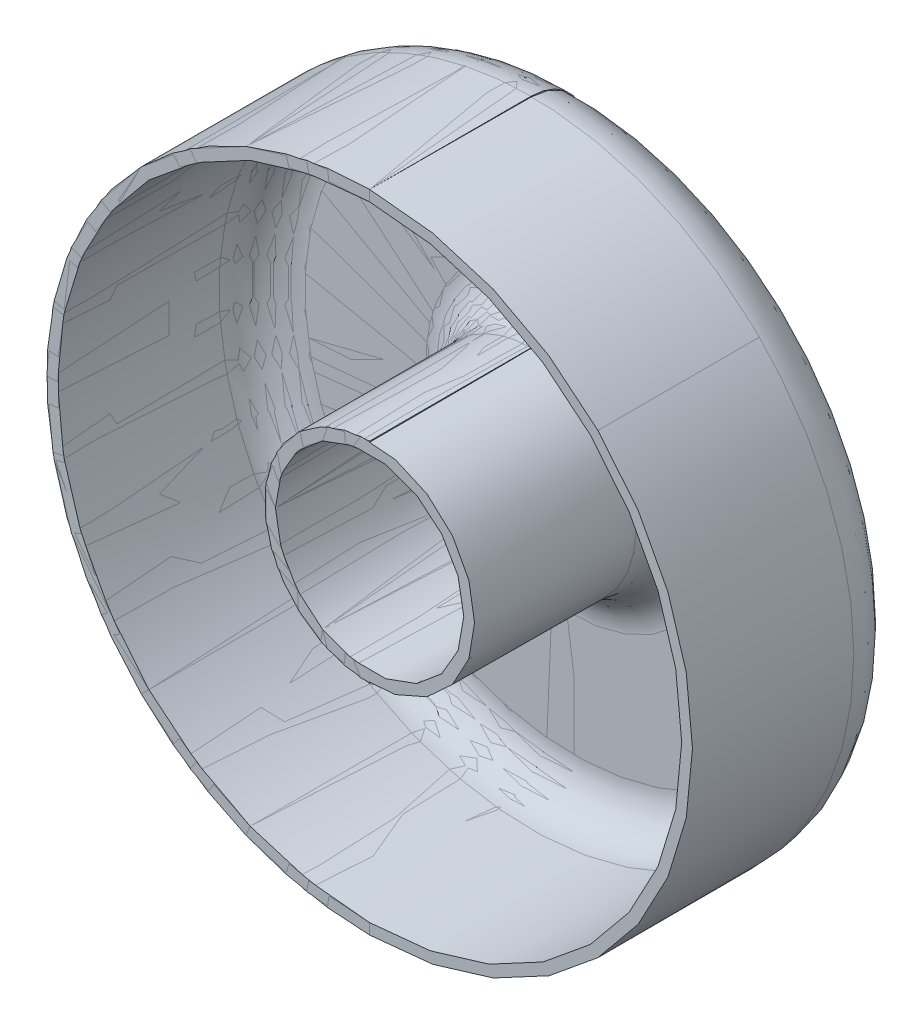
SolidWorks part; units mm, degrees
ref_plane "Front Plane" through (0, 0, 0) normal (0, 0, 1) x (1, 0, 0)
ref_plane "Top Plane" through (0, 0, 0) normal (0, 1, 0) x (1, 0, 0)
ref_plane "Right Plane" through (0, 0, 0) normal (1, 0, 0) x (0, 0, -1)
sketch "Sketch1" plane through (0, 0, 0) normal (0, 0, 1) x (1, 0, 0)
  circle A3 centre (0, 0) radius 60
  dimension "D1" = 120
extrude "Extrude1" add sketch "Sketch1" along normal blind 40
sketch "Sketch2" plane through (0, 0, 40) normal (0, 0, 1) x (1, 0, 0)
  circle A0 centre (0, 0) radius 17.5
  dimension "D1" = 35
extrude "Cut-Extrude1" cut sketch "Sketch2" against normal through all
fillet "Fillet1" radius 10 2 edges at (60, 0, 0) (17.5, 0, 0)
shell "Shell1" thickness 2
ref_plane "Plane1" through (0, 0, 0) normal (0.7071, 0.7071, 0) x (-0.7071, 0.7071, 0)
ref_plane "Plane2" through (0, 0, 0) normal (0.7071, -0.7071, 0) x (0, 0, -1)
sketch "Sketch3" plane through (0, 0, 0) normal (0.7071, 0.7071, 0) x (-0.7071, 0.7071, 0)
  line L0 (0, 40) -> (0, 0)
  line L1 (17.5, 40) -> (-17.5, 40) construction
  line L2 (0, 55.4254) -> (0, -55.4254) construction
  line L3 (-50, 0) -> (50, 0) construction
sketch "Sketch4" plane through (0, 0, 0) normal (0.7071, -0.7071, 0) x (0, 0, -1)
  line L0 (-40.6425, 0) -> (0, 0)
  line L1 (-40, 0) -> (-10, 0) construction
sketch "Sketch5" plane through (0, 0, 0) normal (0, 1, 0) x (1, 0, 0)
  line L0 (0, 0) -> (0, -40)
  line L1 (-42.4264, -40) -> (42.4264, -40) construction
extrude "symmetry" [suppressed] cut sketch "Sketch5" against normal through all and the other way through all
surface "Surface-MidSurface1" [suppressed] parameters "D0"=50000, "D1"=50000, "D4"=50000, "D2"=50000, "D3"=50000, "D5"=50000, "D6"=50000
